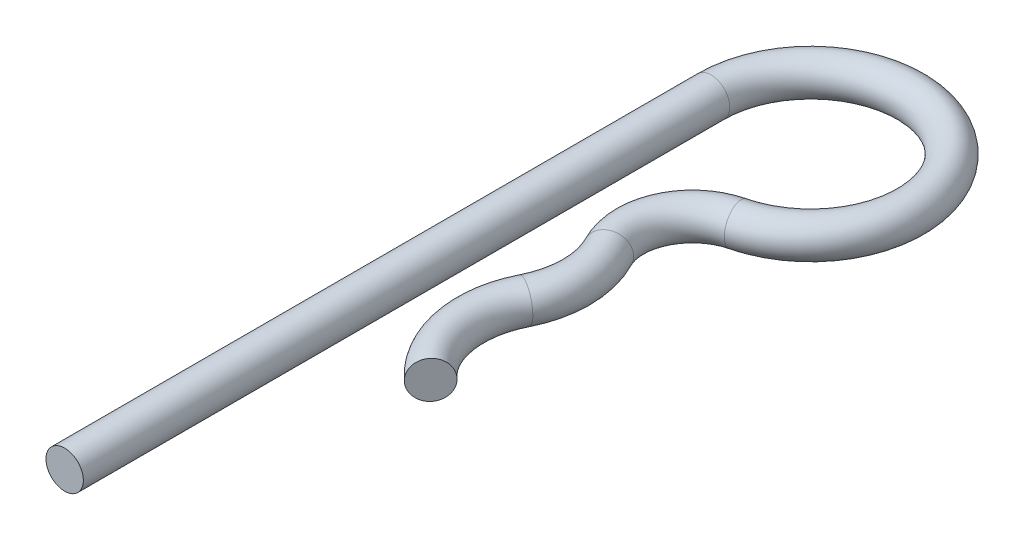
SolidWorks part; units mm, degrees
ref_plane "Face" through (0, 0, 0) normal (0, 0, 1) x (1, 0, 0)
ref_plane "Dessus" through (0, 0, 0) normal (0, 1, 0) x (1, 0, 0)
ref_plane "Droite" through (0, 0, 0) normal (1, 0, 0) x (0, 0, -1)
sketch "Esquisse2" plane through (0, 0, 0) normal (0, 1, 0) x (1, 0, 0)
  line L0 (-50, 0) -> (50, 0) construction
  line L1 (0, 0) -> (0, 51.8631)
  arc A0 (9.9226, 44.0975) -> (0, 51.8631) centre (8, 51.8631) ccw
  arc A1 (9.9226, 44.0975) -> (6.6745, 36.9637) centre (11.1242, 39.2441) ccw
  arc A2 (6.7064, 30.1853) -> (6.6745, 36.9637) centre (0, 33.5431) ccw
  arc A3 (6.7064, 30.1853) -> (8.4471, 20.9203) centre (13.6718, 26.698) ccw
  dimension "D1" = 16
  dimension "D2" = 10
  dimension "D3" = 15
sketch "Esquisse3" plane through (0, 0, 0) normal (0, 0, 1) x (1, 0, 0)
  circle A0 centre (0, 0) radius 1.5
sweep "Balayage1" add profiles "Esquisse3" path "Esquisse2"
